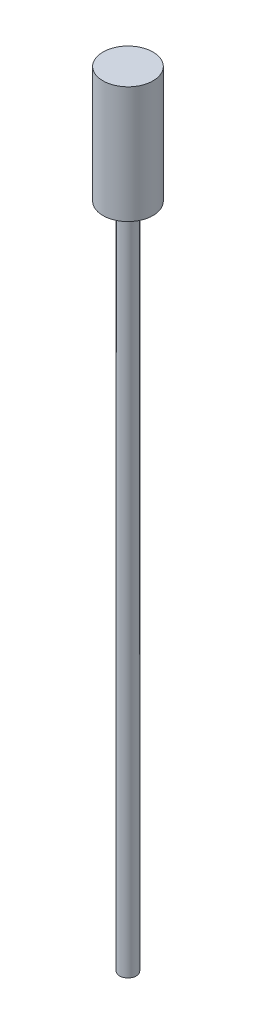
SolidWorks part; units mm, degrees
ref_plane "Front Plane" through (0, 0, 0) normal (0, 0, 1) x (1, 0, 0)
ref_plane "Top Plane" through (0, 0, 0) normal (0, 1, 0) x (1, 0, 0)
ref_plane "Right Plane" through (0, 0, 0) normal (1, 0, 0) x (0, 0, -1)
sketch "Sketch1" plane through (0, 0, 0) normal (0, 1, 0) x (1, 0, 0)
  circle A0 centre (0, 0) radius 3
  dimension "D1" = 6
extrude "Boss-Extrude1" add sketch "Sketch1" along normal blind 14
sketch "Sketch3" plane through (0, 0, 0) normal (0, -1, 0) x (1, 0, 0)
  circle A0 centre (0, 0) radius 1
  dimension "D1" = 2
extrude "Boss-Extrude2" add sketch "Sketch3" along normal blind 80
sketch "Sketch4" plane through (0, 0, 0) normal (0, 0, 1) x (1, 0, 0)
  line L0 (0, 0) -> (0, -80)
  line L1 (-1, -80) -> (1, -80) construction
